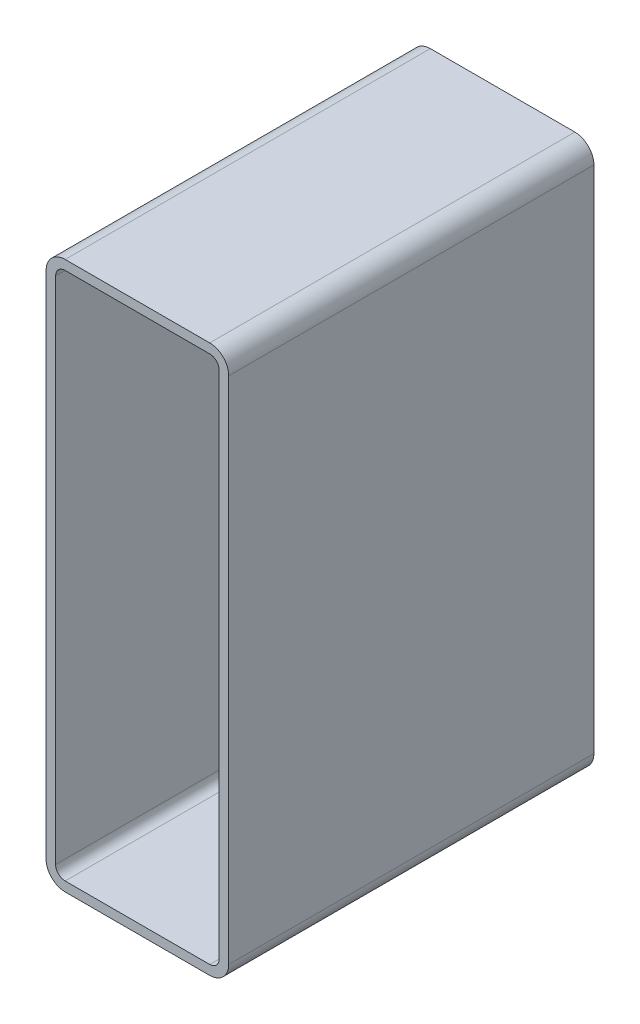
SolidWorks part; units mm, degrees
ref_plane "Front Plane" through (0, 0, 0) normal (0, 0, 1) x (1, 0, 0)
ref_plane "Top Plane" through (0, 0, 0) normal (0, 1, 0) x (1, 0, 0)
ref_plane "Right Plane" through (0, 0, 0) normal (1, 0, 0) x (0, 0, -1)
sketch "Sketch1" plane through (0, 0, 0) normal (0, 0, 1) x (1, 0, 0)
sketch_block_instance "HSS18x6x0.3125-1"
sketch_block "HSS18x6x0.3125"
extrude "Boss-Extrude1" add sketch "Sketch1" along normal blind 304.8
